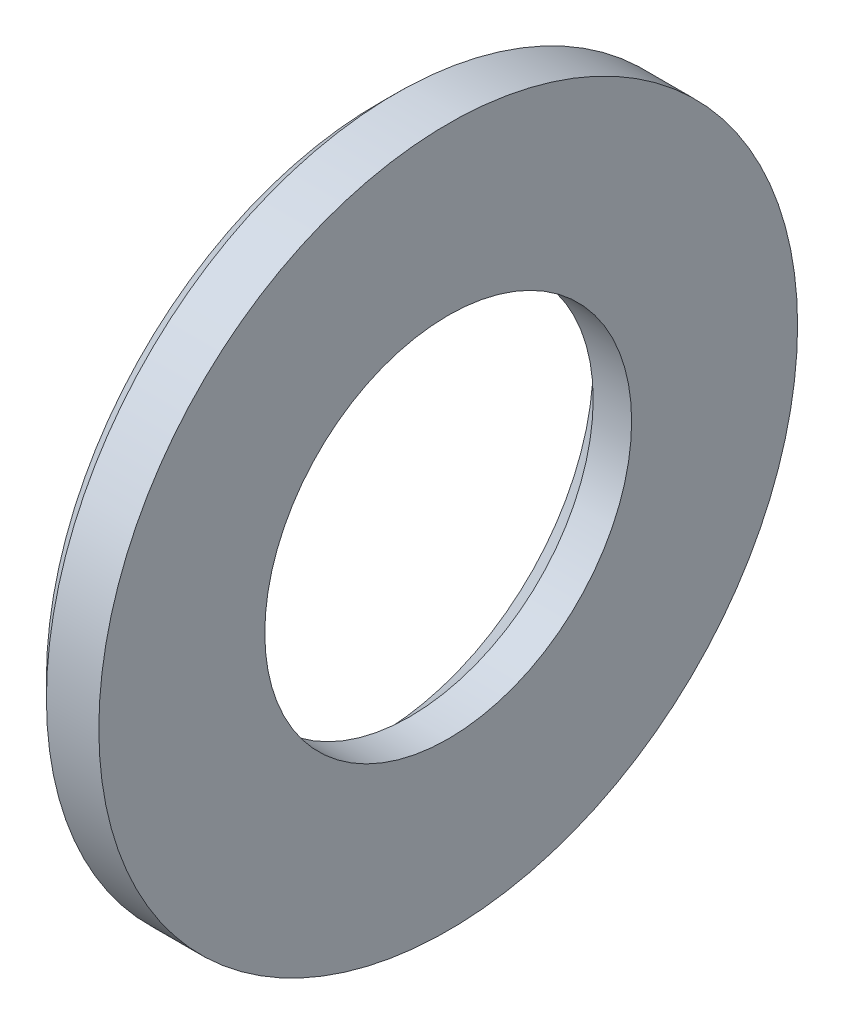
SolidWorks part; units mm, degrees
ref_plane "Plane1" through (0, 0, 0) normal (0, 0, 1) x (1, 0, 0)
ref_plane "Plane2" through (0, 0, 0) normal (0, 1, 0) x (1, 0, 0)
ref_plane "Plane3" through (0, 0, 0) normal (1, 0, 0) x (0, 0, -1)
sketch "Sketch1" plane through (0, 0, 0) normal (0, 0, 1) x (1, 0, 0)
  line L0 (-34.925, 0) -> (9.525, 0) construction
  line L1 (0, 10.5) -> (0, 20)
  line L2 (0, 20) -> (-3, 20)
  line L3 (-4, 19) -> (-4, 12.3)
  line L4 (-2.2, 10.5) -> (0, 10.5)
  line L5 (-4, 19) -> (-3, 20)
  line L7 (-2.2, 10.5) -> (-4, 12.3)
  dimension "D1" = 45
  dimension "D2" = 45
  dimension "Thickness" = 4
  dimension "Inside_dia" = 21
  dimension "Outside_dia" = 40
  dimension "OD_ch_ht" = 1
  dimension "ID_ch_ht" = 1.8
revolve "Base-Revolve" add sketch "Sketch1" angle 360 about L0
